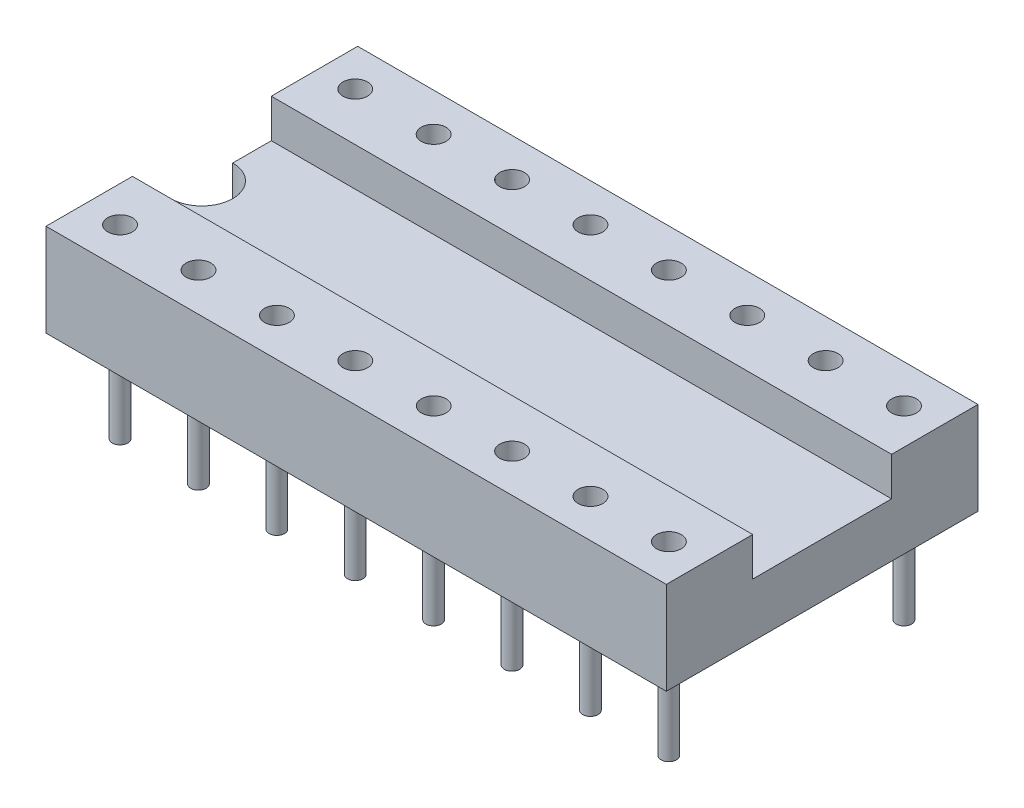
SolidWorks part; units mm, degrees
ref_plane "Plan de face" through (0, 0, 0) normal (0, 0, 1) x (1, 0, 0)
ref_plane "Plan de dessus" through (0, 0, 0) normal (0, 1, 0) x (1, 0, 0)
ref_plane "Plan de droite" through (0, 0, 0) normal (1, 0, 0) x (0, 0, -1)
sketch "Esquisse1" plane through (0, 0, 0) normal (1, 0, 0) x (0, 0, -1)
  line L0 (12.2051, 0) -> (-23.3437, 0) construction
  line L1 (0, -4.6214) -> (0, 25.9507) construction
  line L2 (-5.7968, 1.75) -> (2.763, 1.75) construction
  line L3 (5.7565, 3) -> (-6.8307, 3) construction
  line L4 (5.05, 3.8077) -> (5.05, -1.0493) construction
  line L5 (-5.05, 3.7235) -> (-5.05, -1.0493) construction
  line L6 (-2.25, 3.5071) -> (-2.25, 0.8142) construction
  line L7 (2.25, 3.5071) -> (2.25, 0.8142) construction
  line L8 (-2.25, 1.75) -> (-2.25, 3)
  line L9 (-2.25, 3) -> (-5.05, 3)
  line L10 (-5.05, 3) -> (-5.05, 0)
  line L11 (-5.05, 0) -> (5.05, 0)
  line L12 (5.05, 0) -> (5.05, 3)
  line L13 (5.05, 3) -> (2.25, 3)
  line L14 (2.25, 3) -> (2.25, 1.75)
  line L15 (2.25, 1.75) -> (-2.25, 1.75)
  dimension "D1" = 1.75
  dimension "D2" = 3
  dimension "D3" = 5.05
  dimension "D4" = 5.05
  dimension "D5" = 2.8
  dimension "D6" = 2.8
extrude "Extrusion1" add sketch "Esquisse1" along normal blind 20.1
sketch "Esquisse2" plane through (0, 1.75, 0) normal (0, 1, 0) x (-1, 0, 0)
  line L0 (0, -1) -> (0, 1)
  arc A0 (0, 1) -> (0, -1) centre (0, 0) ccw
extrude "Enlèv. mat.-Extru.1" cut sketch "Esquisse2" against normal through all
sketch "Esquisse3" plane through (0, 3, 0) normal (0, 1, 0) x (-1, 0, 0)
  line L0 (-13.1576, 5.05) -> (2.3638, 5.05) construction
  line L1 (0, 6.1465) -> (0, -6.3771) construction
  line L2 (1.5124, 0) -> (-12.9979, 0) construction
  line L3 (1.0512, 3.81) -> (-15.6055, 3.81) construction
  line L4 (-1.16, 6.2884) -> (-1.16, 1.7827) construction
  circle A0 centre (-1.16, 3.81) radius 0.4
  circle A1 centre (-1.16, -3.81) radius 0.4
  circle A2 centre (-3.701, 3.81) radius 0.4
  circle A3 centre (-3.701, -3.81) radius 0.4
  circle A4 centre (-6.242, 3.81) radius 0.4
  circle A5 centre (-6.242, -3.81) radius 0.4
  circle A6 centre (-8.783, 3.81) radius 0.4
  circle A7 centre (-8.783, -3.81) radius 0.4
  circle A8 centre (-11.323, 3.81) radius 0.4
  circle A9 centre (-11.323, -3.81) radius 0.4
  circle A10 centre (-13.863, 3.81) radius 0.4
  circle A11 centre (-13.863, -3.81) radius 0.4
  circle A12 centre (-16.403, 3.81) radius 0.4
  circle A13 centre (-16.403, -3.81) radius 0.4
  circle A14 centre (-18.943, 3.81) radius 0.4
  circle A15 centre (-18.943, -3.81) radius 0.4
  dimension "D3" = 4
  dimension "D1" = 1.24
  dimension "D2" = 1.16
extrude "Enlèv. mat.-Extru.2" cut sketch "Esquisse3" against normal blind 2.5
sketch "Esquisse5" plane through (0, 0, 0) normal (0, -1, 0) x (1, 0, 0)
  line L0 (-0.4263, 0) -> (10.6481, 0) construction
  circle A0 centre (1.16, 3.81) radius 0.25
  circle A1 centre (1.16, -3.81) radius 0.25
  circle A2 centre (3.7, -3.81) radius 0.25
  circle A3 centre (3.7, 3.81) radius 0.25
  circle A4 centre (6.24, -3.81) radius 0.25
  circle A5 centre (6.24, 3.81) radius 0.25
  circle A6 centre (8.78, -3.81) radius 0.25
  circle A7 centre (8.78, 3.81) radius 0.25
  circle A8 centre (11.32, -3.81) radius 0.25
  circle A9 centre (11.32, 3.81) radius 0.25
  circle A10 centre (13.86, -3.81) radius 0.25
  circle A11 centre (13.86, 3.81) radius 0.25
  circle A12 centre (16.4, -3.81) radius 0.25
  circle A13 centre (16.4, 3.81) radius 0.25
  circle A14 centre (18.94, -3.81) radius 0.25
  circle A15 centre (18.94, 3.81) radius 0.25
  dimension "D1" = 4
extrude "Extrusion2" add sketch "Esquisse5" along normal blind 3
